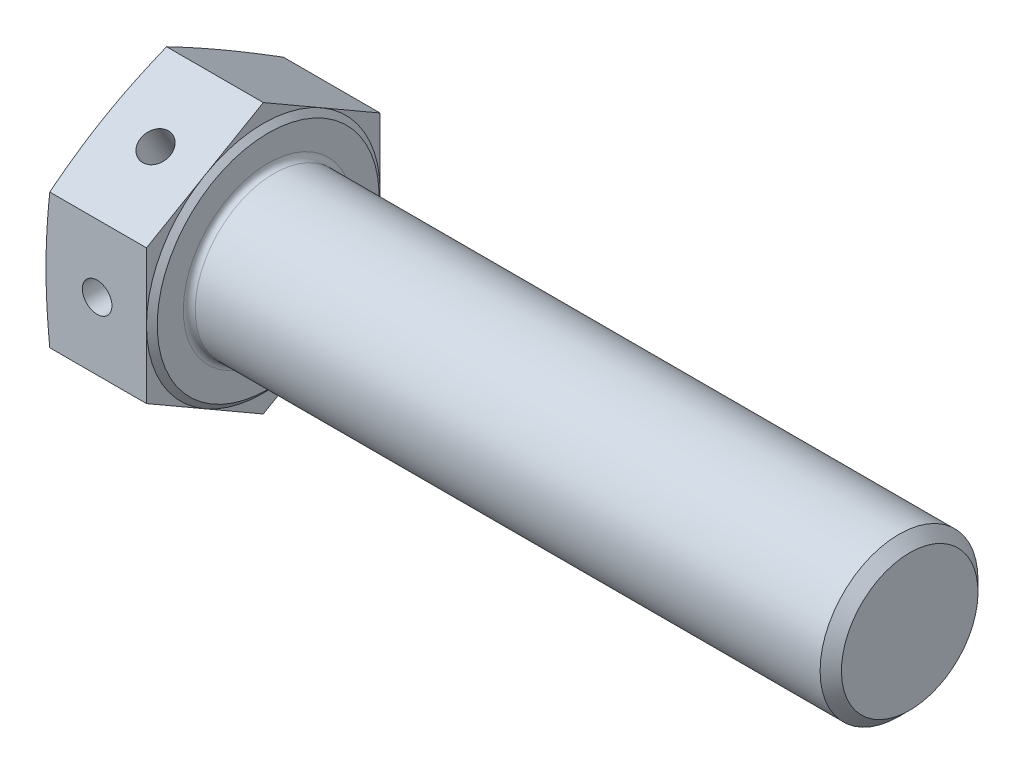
SolidWorks part; units mm, degrees
ref_plane "Front" through (0, 0, 0) normal (0, 0, 1) x (1, 0, 0)
ref_plane "Top" through (0, 0, 0) normal (0, 1, 0) x (1, 0, 0)
ref_plane "Right" through (0, 0, 0) normal (1, 0, 0) x (0, 0, -1)
sketch "Sketch-BaseHead" plane through (0, 0, 0) normal (1, 0, 0) x (0, 0, -1)
  line L1 (0, -13.6659) -> (11.835, -6.8329)
  line L2 (11.835, -6.8329) -> (11.835, 6.8329)
  line L3 (11.835, 6.8329) -> (0, 13.6659)
  line L4 (0, 13.6659) -> (-11.835, 6.8329)
  line L5 (-11.835, 6.8329) -> (-11.835, -6.8329)
  line L6 (-11.835, -6.8329) -> (0, -13.6659)
  circle A0 centre (0, 0) radius 11.835 construction
  dimension "s" = 23.67
extrude "BaseHead" add sketch "Sketch-BaseHead" along normal blind 10.18
sketch "Sketch4" plane through (-0.2646, -5.9169, 0) normal (0, 0, 1) x (0, 1, 0)
  line L0 (5.9169, 3.7369) -> (5.9169, -10.4477) construction
  line L2 (19.5828, -0.2646) -> (17.7519, -0.2646)
  line L4 (17.7519, -0.2646) -> (19.5828, -0.6483)
  line L6 (19.5828, -0.6483) -> (19.5828, -0.2646)
  dimension "D1" = 11.835
  dimension "D2" = 23.67
revolve "HeadChamfer" cut sketch "Sketch4" angle 360 about L0
sketch "Sketch2" plane through (0, 0, 0) normal (0, 1, 0) x (1, 0, 0)
  line L0 (10.18, 0) -> (10.68, 0)
  line L1 (10.68, 0) -> (10.68, 11.245)
  line L2 (10.68, 11.245) -> (10.18, 11.835)
  line L3 (10.18, 11.835) -> (10.18, 0)
  line L4 (10.18, 11.835) -> (10.18, 0) construction
  dimension "D1" = 11.835
  dimension "D2" = 11.245
  dimension "c" = 0.5
revolve "Revolve1" add sketch "Sketch2" angle 360 about axis through (-4.0016, 0, 0) along (1, 0, 0)
ref_plane "Plane2" through (37.68, 0, 0) normal (1, 0, 0) x (0, 0, -1)
sketch "Sketch3" plane through (10.68, 0, 0) normal (1, 0, 0) x (0, 0, -1)
  circle A0 centre (0, 0) radius 8
  dimension "d" = 16
extrude "BaseBody" add sketch "Sketch3" along normal blind 65
chamfer "Chamfer1" distance 1.0825 angle 45 1 edges at (75.68, 8, 0)
fillet "HeadFillet" radius 0.6 1 edges at (10.68, -8, 0)
sketch "Sketch5" plane through (0, 0, 0) normal (0, 0, 1) x (1, 0, 0)
  line L1 (10.18, -10.2494) -> (10.18, -13.6659) construction
  line L2 (-4.0016, 0) -> (10.1831, 0) construction
  circle A0 centre (5.18, 0) radius 1.5
  dimension "d1" = 3
  dimension "h" = 5
extrude "Hole" cut sketch "Sketch5" against normal through all and the other way through all
pattern_circular "CirPattern1" count 2 over 60 about axis through (75.68, 0, 0) along (-1, 0, 0) of "Hole"
equation "\"D1@Sketch4\" = \"s@Sketch-BaseHead\"/ 2 "
equation "\"D2@Sketch4\" = \"s@Sketch-BaseHead\""
equation "\"D1@Chamfer1\" =  ( \"d@Sketch3\" - \"D2@ThreadCosmetic1\" ) / 2 "
equation "\"b@ThreadCosmetic1\" = \"l@BaseBody\" - \"lg@Plane2\""
equation "\"D1@Sketch2\"=\"s@Sketch-BaseHead\"/2"
